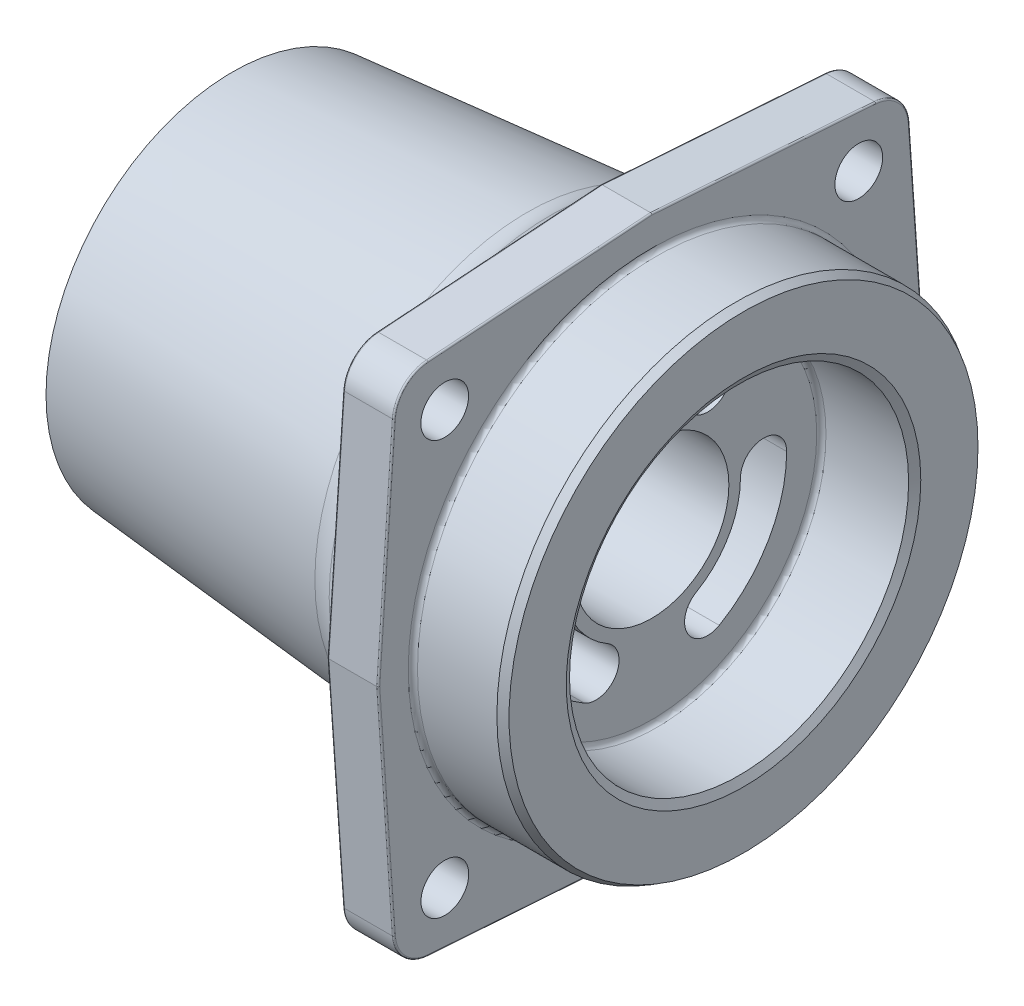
SolidWorks part; units mm, degrees
ref_plane "Front Plane" through (0, 0, 0) normal (0, 0, 1) x (1, 0, 0)
ref_plane "Top Plane" through (0, 0, 0) normal (0, 1, 0) x (1, 0, 0)
ref_plane "Right Plane" through (0, 0, 0) normal (1, 0, 0) x (0, 0, -1)
sketch "Sketch1" plane through (0, 0, 0) normal (1, 0, 0) x (0, 0, -1)
  circle A0 centre (0, 0) radius 15.5
  dimension "D1" = 31
extrude "Boss-Extrude1" add sketch "Sketch1" along normal blind 5.95
sketch "Sketch2" plane through (0, 0, 0) normal (-1, 0, 0) x (0, 0, 1)
  line L0 (-13.435, -13.435) -> (13.435, 13.435) construction
  line L9 (13.435, -13.435) -> (-13.435, 13.435) construction
  line L10 (-13.435, -13.435) -> (13.435, 13.435) construction
  line L11 (0, 17.75) -> (-14.5269, 16.7342)
  line L12 (17.75, 0) -> (16.7342, 14.5269)
  line L13 (-17.75, 0) -> (-16.7351, 14.5259)
  line L14 (0, 17.75) -> (14.5259, 16.7351)
  line L15 (0, -17.75) -> (14.5269, -16.7342)
  line L16 (17.75, 0) -> (16.7351, -14.5259)
  line L17 (-17.75, 0) -> (-16.7342, -14.5269)
  line L18 (0, -17.75) -> (-14.5259, -16.7351)
  circle A0 centre (0, 0) radius 15.5 construction
  circle A5 centre (-13.4262, 13.4253) radius 1.55
  circle A6 centre (13.435, 13.435) radius 1.55
  circle A7 centre (13.4262, -13.4253) radius 1.55
  circle A8 centre (-13.435, -13.435) radius 1.55
  circle A9 centre (0, 0) radius 15.5 construction
  arc A10 (-14.5269, 16.7342) -> (-16.7351, 14.5259) centre (-14.3609, 14.36) ccw
  arc A11 (16.7342, 14.5269) -> (14.5259, 16.7351) centre (14.36, 14.3609) ccw
  arc A12 (14.5269, -16.7342) -> (16.7351, -14.5259) centre (14.3609, -14.36) ccw
  arc A13 (-16.7342, -14.5269) -> (-14.5259, -16.7351) centre (-14.36, -14.3609) ccw
  dimension "D1" = 3.1
  dimension "D2" = 3.1
  dimension "D3" = 3.1
  dimension "D4" = 3.1
extrude "Boss-Extrude4" add sketch "Sketch2" along normal blind 3.3
ref_plane "Plane2" through (-27.2, 0, 0) normal (-1, 0, 0) x (0, 0, 1)
sketch "Sketch5" plane through (-27.2, 0, 0) normal (-1, 0, 0) x (0, 0, 1)
  circle A0 centre (0, 0) radius 12.1
extrude "Boss-Extrude5" add sketch "Sketch5" against normal up to surface (23.9 mm away) draft 5
chamfer "Chamfer3" distance 4 angle 30 1 edges at (-3.3, 0, 14.191)
fillet "Fillet5" radius 1 1 edges at (-3.3, 0, 16.6325)
fillet "Fillet6" radius 3 1 edges at (-7.2848, 0, -13.8424)
sketch "Sketch6" plane through (-3.3, 0, 0) normal (-1, 0, 0) x (0, 0, 1)
  circle A0 centre (-13.4262, 13.4253) radius 3
  circle A1 centre (13.435, 13.435) radius 3
  circle A2 centre (13.4262, -13.4253) radius 3
  circle A3 centre (-13.435, -13.435) radius 3
  dimension "D1" = 6
  dimension "D2" = 6
  dimension "D3" = 6
  dimension "D4" = 6
extrude "Cut-Extrude1" cut sketch "Sketch6" against normal blind 0.5 and the other way blind 3.3
sketch "Sketch7" plane through (5.95, 0, 0) normal (1, 0, 0) x (0, 0, -1)
  circle A0 centre (0, 0) radius 11
  dimension "D1" = 22
extrude "Cut-Extrude2" cut sketch "Sketch7" against normal blind 5.95
sketch "Sketch8" plane through (-27.2, 0, 0) normal (-1, 0, 0) x (0, 0, 1)
  circle A0 centre (0, 0) radius 9.525
  dimension "D1" = 19.05
extrude "Cut-Extrude3" cut sketch "Sketch8" against normal blind 5.54
sketch "Sketch9" plane through (0, 0, 0) normal (1, 0, 0) x (0, 0, -1)
  circle A0 centre (0, 0) radius 5
  dimension "D1" = 10
extrude "Cut-Extrude4" cut sketch "Sketch9" against normal up to surface (21.66 mm away)
sketch "Sketch10" plane through (0, 0, 0) normal (1, 0, 0) x (0, 0, -1)
  line L0 (0, 0) -> (0, 12.9465) construction
  arc A0 (-3.625, 6.2787) -> (3.625, 6.2787) centre (0, 0) cw construction
  arc A1 (4.375, 7.5777) -> (-4.375, 7.5777) centre (0, 0) ccw
  arc A2 (2.875, 4.9796) -> (-2.875, 4.9796) centre (0, 0) ccw
  arc A3 (2.875, 4.9796) -> (4.375, 7.5777) centre (3.625, 6.2787) ccw
  arc A4 (-4.375, 7.5777) -> (-2.875, 4.9796) centre (-3.625, 6.2787) ccw
  arc A5 (7.25, 0) -> (3.625, -6.2787) centre (0, 0) cw construction
  arc A6 (4.375, -7.5777) -> (8.75, 0) centre (0, 0) ccw
  arc A7 (2.875, -4.9796) -> (5.75, 0) centre (0, 0) ccw
  arc A8 (2.875, -4.9796) -> (4.375, -7.5777) centre (3.625, -6.2787) ccw
  arc A9 (8.75, 0) -> (5.75, 0) centre (7.25, 0) ccw
  arc A10 (-3.625, -6.2787) -> (-7.25, 0) centre (0, 0) cw construction
  arc A11 (-8.75, 0) -> (-4.375, -7.5777) centre (0, 0) ccw
  arc A12 (-5.75, 0) -> (-2.875, -4.9796) centre (0, 0) ccw
  arc A13 (-5.75, 0) -> (-8.75, 0) centre (-7.25, 0) ccw
  arc A14 (-4.375, -7.5777) -> (-2.875, -4.9796) centre (-3.625, -6.2787) ccw
  point P4 (0, 7.25)
  point P17 (6.2787, -3.625)
  point P24 (-6.2787, -3.625)
  point P29 (0, 0)
  dimension "D1" = 3
  dimension "D3" = 7.25
  dimension "D4" = 3
  dimension "D2" = 60
extrude "Cut-Extrude5" cut sketch "Sketch10" against normal up to surface (21.66 mm away)
fillet "Fillet2" radius 0.3 3 edges at (0, 0, 15.5) (0, 0, -11) (-21.66, 0, 9.525)
chamfer "Chamfer1" distance 0.5 angle 30 2 edges at (5.95, 0, -15.5) (5.95, 0, -11)
chamfer "Chamfer2" distance 0.5 angle 30 1 edges at (-27.2, 0, 9.525)
fillet "Fillet3" radius 0.1 24 edges at (-3.3, -17.2426, -7.2629) (-3.3, -16.0439, -16.0428) (-3.3, 7.2629, -17.2426) (-3.3, 16.0428, -16.0439) (-3.3, -17.2421, 7.2635) (-3.3, -16.0428, 16.0439) (-3.3, 17.2426, 7.2629) (-3.3, 16.0439, 16.0428) (0, -17.2421, 7.2635) (0, -16.0428, 16.0439) (0, 7.2635, 17.2421) (0, 16.0439, 16.0428) (0, -17.2426, -7.2629) (0, -16.0439, -16.0428) (0, 7.2629, -17.2426) (0, 16.0428, -16.0439) (-3.3, -7.2635, -17.2421) (-3.3, 17.2421, -7.2635) (-3.3, -7.2629, 17.2426) (-3.3, 7.2635, 17.2421) (0, -7.2629, 17.2426) (0, 17.2426, 7.2629) (0, -7.2635, -17.2421) (0, 17.2421, -7.2635)
